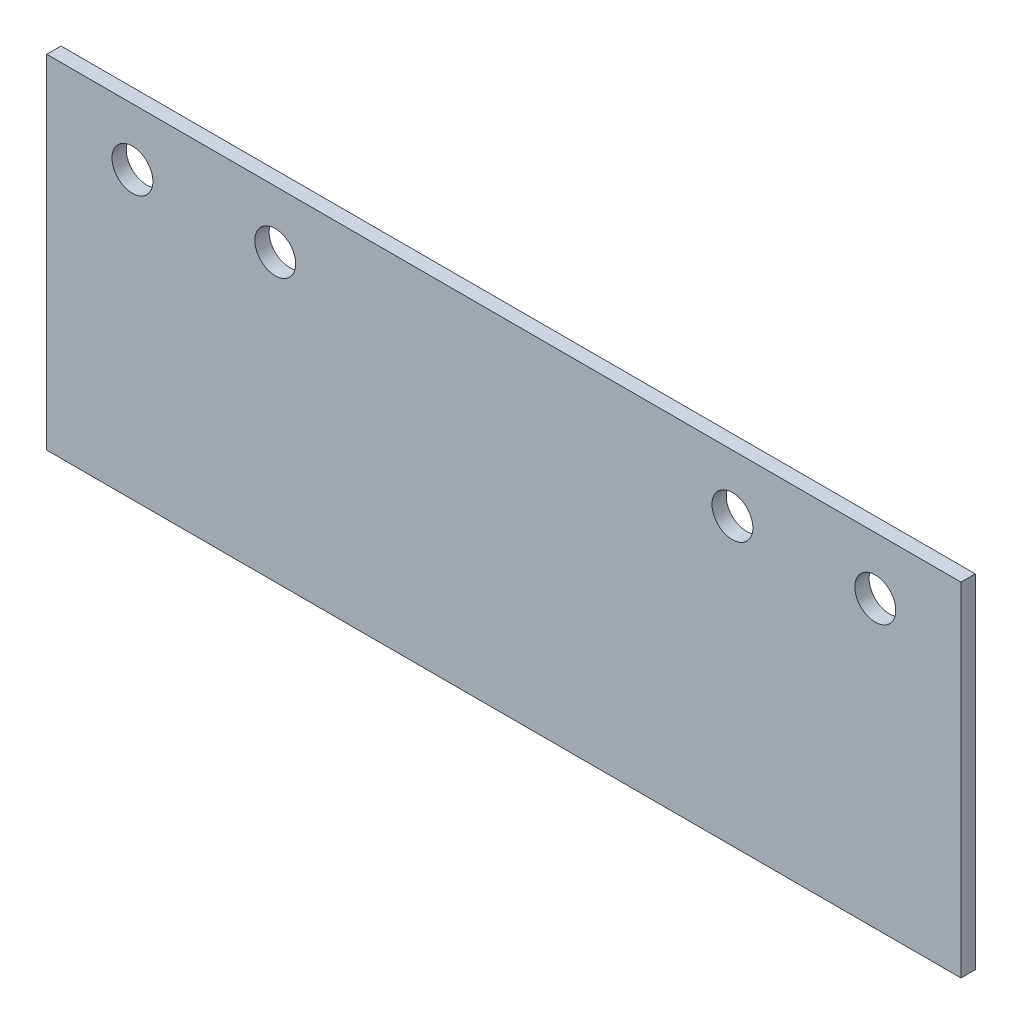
SolidWorks part; units mm, degrees
ref_plane "Front Plane" through (0, 0, 0) normal (0, 0, 1) x (1, 0, 0)
ref_plane "Top Plane" through (0, 0, 0) normal (0, 1, 0) x (1, 0, 0)
ref_plane "Right Plane" through (0, 0, 0) normal (1, 0, 0) x (0, 0, -1)
sketch "Sketch1" plane through (0, 0, 0) normal (0, 0, 1) x (1, 0, 0)
  line L1 (203.2, 0) -> (0, 0)
  line L2 (203.2, 0) -> (203.2, 76.2)
  line L3 (203.2, 76.2) -> (0, 76.2)
  line L4 (0, 0) -> (0, 76.2)
  dimension "D3" = 76.2
  dimension "D4" = 203.2
extrude "Boss-Extrude1" add sketch "Sketch1" along normal blind 3.175
hole_wizard "T (0.358) Diameter Hole1" positions "Sketch4" profile "Sketch5" hole size "T" standard "ANSI Inch"
sketch "Sketch4" plane through (0, 0, 3.175) normal (0, 0, 1) x (1, 0, 0)
  line L0 (203.2, 0) -> (203.2, 76.2) construction
  line L1 (203.2, 76.2) -> (0, 76.2) construction
  line L2 (101.6, 0) -> (101.6, 76.2) construction
  line L3 (0, 0) -> (203.2, 0) construction
  point P0 (184.15, 63.5)
  point P2 (19.05, 63.5)
  point P4 (152.4, 63.5)
  point P6 (50.8, 63.5)
  dimension "D1" = 19.05
  dimension "D2" = 50.8
  dimension "D3" = 12.7
sketch "Sketch5" plane through (184.15, 63.5, 3.175) normal (1, 0, 0) x (0, -1, 0)
  line L0 (0, 0) -> (0, 3.175)
  line L1 (0, 3.175) -> (4.5466, 3.175)
  line L2 (4.5466, 3.175) -> (4.5466, 0)
  line L5 (4.5466, 0) -> (0, 0)
  line L11 (0, -6.35) -> (0, 107.95) construction
  dimension "Thru Hole Dia." = 9.0932
  dimension "Thru Hole Depth" = 3.175
